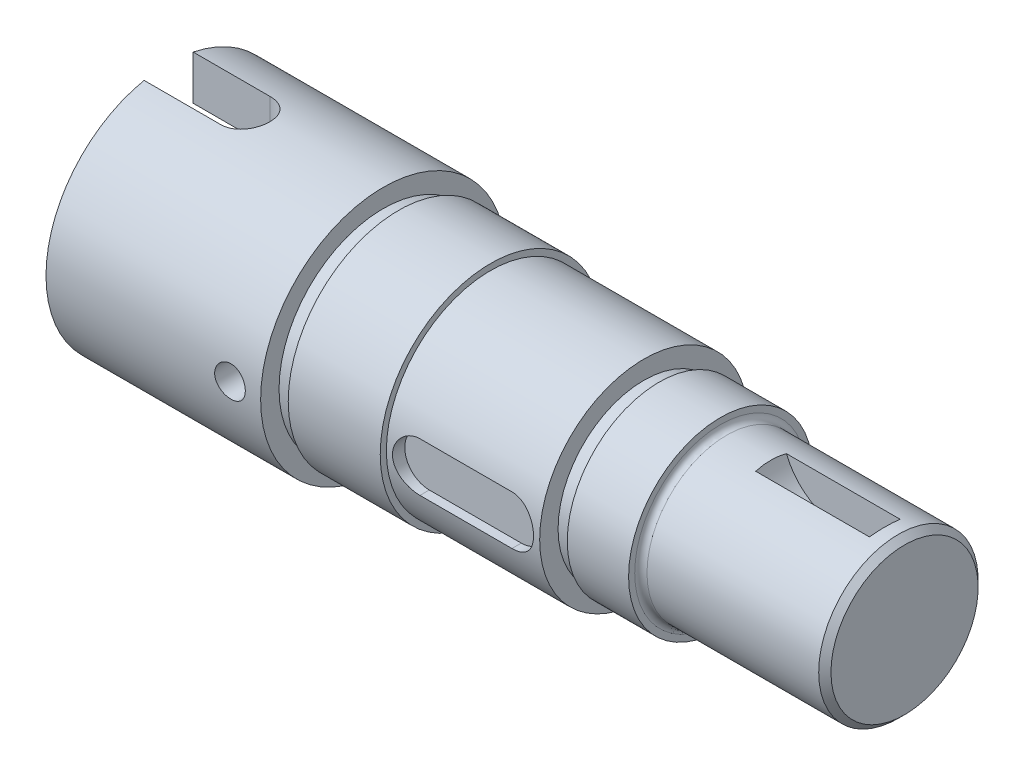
SolidWorks part; units mm, degrees
ref_plane "前视基准面" through (0, 0, 0) normal (0, 0, 1) x (1, 0, 0)
ref_plane "上视基准面" through (0, 0, 0) normal (0, 1, 0) x (1, 0, 0)
ref_plane "右视基准面" through (0, 0, 0) normal (1, 0, 0) x (0, 0, -1)
sketch "草图1" plane through (0, 0, 0) normal (0, 0, 1) x (1, 0, 0)
  line L0 (-79.083, 0) -> (124.681, 0) construction
  line L1 (-105, 0) -> (-105, 40)
  line L2 (-105, 40) -> (-35, 40)
  line L3 (-35, 40) -> (-35, 34)
  line L4 (-35, 34) -> (-30, 34)
  line L5 (-30, 34) -> (-30, 36)
  line L6 (-30, 36) -> (0, 36)
  line L7 (0, 34) -> (50, 34)
  line L8 (50, 34) -> (50, 28)
  line L9 (50, 28) -> (55, 28)
  line L10 (55, 28) -> (55, 30)
  line L11 (55, 30) -> (75, 30)
  line L12 (75, 30) -> (75, 26)
  line L13 (75, 26) -> (133, 26)
  line L14 (133, 26) -> (135, 24)
  line L15 (135, 24) -> (135, 0)
  line L16 (135, 0) -> (-105, 0)
  line L17 (0, 36) -> (0, 34)
  line L18 (0, 0) -> (0, 57.8256) construction
  dimension "D1" = 40
  dimension "D2" = 34
  dimension "D3" = 36
  dimension "D4" = 28
  dimension "D5" = 30
  dimension "D6" = 26
  dimension "D7" = 24
  dimension "D8" = 2
  dimension "D9" = 70
  dimension "D10" = 5
  dimension "D11" = 30
  dimension "D12" = 50
  dimension "D13" = 5
  dimension "D14" = 20
  dimension "D15" = 60
revolve "旋转1" add sketch "草图1" angle 360 about L0
sketch "草图2" plane through (0, 0, 0) normal (0, 0, 1) x (1, 0, 0)
  line L1 (90, 33) -> (130, 33)
  line L2 (135, -24) -> (135, 24) construction
  line L4 (153.9856, 33) -> (51.0689, 33) construction
  arc A0 (90, 33) -> (130, 33) centre (110, 33) ccw
  dimension "D1" = 20
  dimension "D2" = 33
  dimension "D3" = 25
sketch "草图3" plane through (0, 0, 0) normal (0, 0, 1) x (1, 0, 0)
  line L0 (0, 0) -> (-117.9502, 0) construction
  circle A0 centre (-45, 0) radius 5
  dimension "D1" = 10
  dimension "D2" = 45
extrude "切除-拉伸1" cut sketch "草图3" against normal mid plane 100
ref_plane "基准面1" through (0, 0, 30) normal (0, 0, 1) x (1, 0, 0)
sketch "草图4" plane through (0, 0, 30) normal (0, 0, 1) x (1, 0, 0)
  line L0 (0, 0) -> (150.2239, 0) construction
  line L1 (10, 8) -> (40, 8)
  line L2 (40, -8) -> (10, -8)
  arc A0 (40, 8) -> (40, -8) centre (40, 0) cw
  arc A1 (10, -8) -> (10, 8) centre (10, 0) cw
  dimension "D1" = 10
  dimension "D2" = 30
  dimension "D3" = 16
extrude "切除-拉伸2" cut sketch "草图4" along normal blind 100
sketch "草图5" plane through (0, 0, 0) normal (0, 1, 0) x (1, 0, 0)
  line L0 (0, 0) -> (-127.5317, 0) construction
  line L1 (-105, 25.9808) -> (-70, 25.9808)
  line L2 (-105, 40) -> (-105, -40) construction
  line L3 (-70, 25.9808) -> (-55, 0)
  line L4 (-55, 0) -> (-105, 0)
  line L5 (-105, 0) -> (-105, 25.9808)
  dimension "D1" = 60
  dimension "D2" = 35
  dimension "D3" = 50
revolve "切除-旋转2" cut sketch "草图5" angle 360 about L0
sketch "草图6" plane through (0, 0, 0) normal (0, 1, 0) x (1, 0, 0)
  line L0 (0, 0) -> (-115.6513, 0) construction
  line L1 (-105, 8) -> (-80, 8)
  line L2 (-105, 40) -> (-105, -40) construction
  line L3 (-80, -8) -> (-105, -8)
  line L4 (-105, -8) -> (-105, 8)
  arc A0 (-80, 8) -> (-80, -8) centre (-80, 0) cw
  dimension "D1" = 25
  dimension "D2" = 16
extrude "切除-拉伸3" cut sketch "草图6" against normal mid plane 100
fillet "圆角1" radius 2 1 edges at (75, 0, 26)
extrude "切除-拉伸4" cut sketch "草图2" against normal mid plane 10
